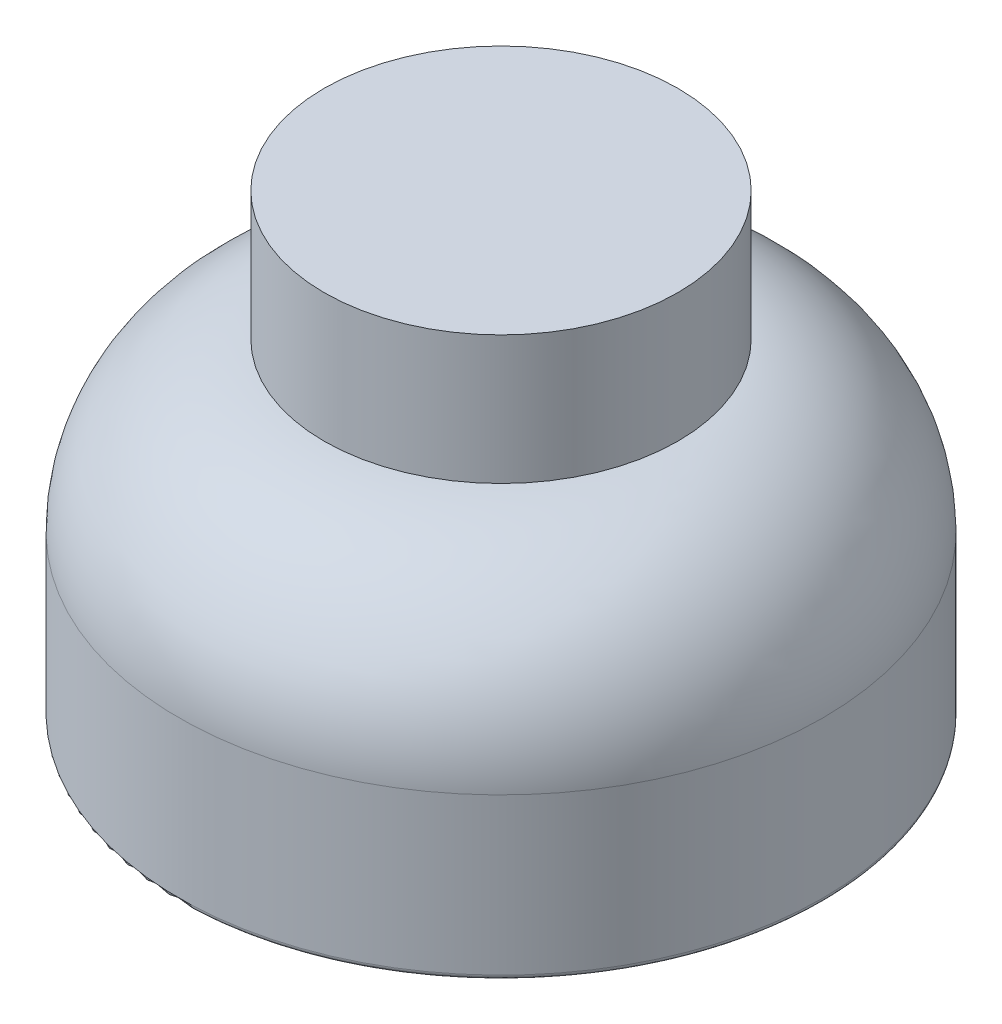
SolidWorks part; units mm, degrees
ref_plane "Alzado" through (0, 0, 0) normal (0, 0, 1) x (1, 0, 0)
ref_plane "Planta" through (0, 0, 0) normal (0, 1, 0) x (1, 0, 0)
ref_plane "Vista lateral" through (0, 0, 0) normal (1, 0, 0) x (0, 0, -1)
sketch "Croquis1" plane through (0, 0, 0) normal (0, 0, 1) x (1, 0, 0)
  line L0 (0, 30) -> (0, -70)
  line L1 (50, 30) -> (0, 30)
  line L2 (100, -20) -> (100, -70)
  line L3 (100, -70) -> (0, -70)
  line L5 (100, 30) -> (0, 0) construction
  line L6 (100, -70) -> (0, 0) construction
  arc A0 (50, 30) -> (100, -20) centre (50, -20) cw
  point P0 (0, 0)
  dimension "D3" = 50
  dimension "D1" = 100
  dimension "D2" = 100
revolve "Revolución1" add sketch "Croquis1" angle 360 about L0
shell "Vaciado1" thickness 3
fillet "Redondeo1" radius 1.5 2 edges at (-100, -70, 0) (-97, -70, 0)
sketch "Croquis2" plane through (0, 27, 0) normal (0, -1, 0) x (1, 0, 0)
  circle A0 centre (0, 0) radius 50
  dimension "D1" = 100
extrude "Saliente-Extruir1" add sketch "Croquis2" along normal blind 2 separate body
sketch "Croquis3" plane through (0, 25, 0) normal (0, -1, 0) x (1, 0, 0)
  circle A1 centre (0, 0) radius 50
  circle A2 centre (0, 0) radius 50
  dimension "D1" = 0
extrude "Saliente-Extruir2" add sketch "Croquis3" along normal blind 20 separate body
sketch "Croquis4" plane through (0, 5, 0) normal (0, -1, 0) x (1, 0, 0)
  circle A1 centre (0, 0) radius 50
  circle A2 centre (0, 0) radius 50
  dimension "D1" = 0
extrude "Saliente-Extruir3" add sketch "Croquis4" along normal blind 15 separate body
fillet "Redondeo2" radius 10 1 edges at (0, -10, -50)
sketch "Croquis5" plane through (0, 30, 0) normal (0, 1, 0) x (1, 0, 0)
  circle A0 centre (0, 0) radius 50
  dimension "D1" = 100
extrude "Saliente-Extruir4" add sketch "Croquis5" along normal blind 2 separate body
sketch "Croquis10" plane through (0, 32, 0) normal (0, 1, 0) x (1, 0, 0)
  circle A0 centre (0, 0) radius 54.991
  dimension "D1" = 109.982
extrude "Saliente-Extruir8" add sketch "Croquis10" along normal blind 40
